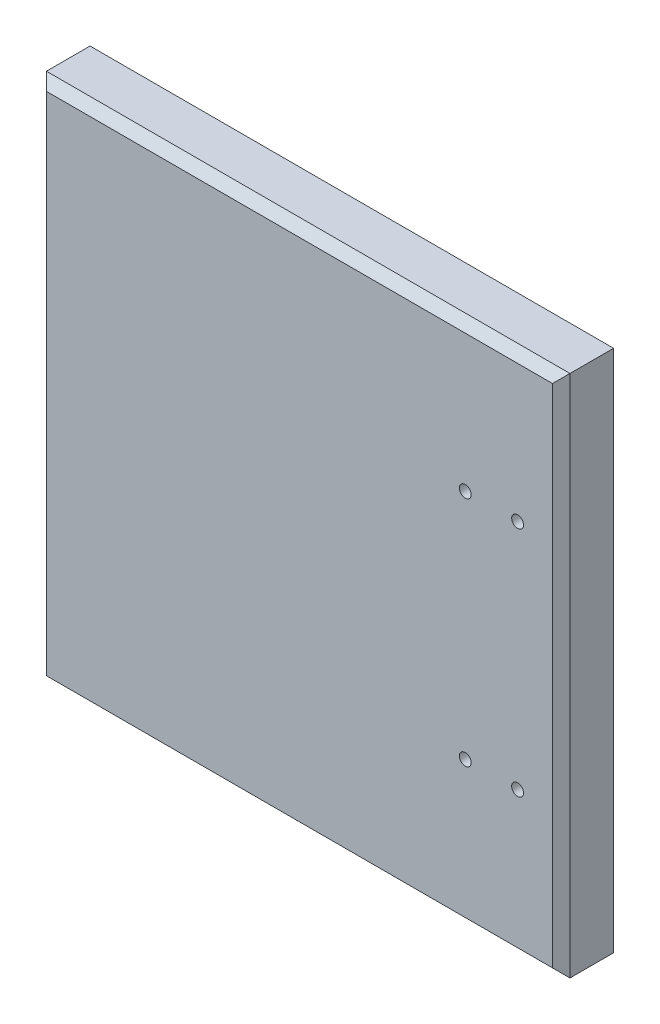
SolidWorks part; units mm, degrees
ref_plane "Face" through (0, 0, 0) normal (0, 0, 1) x (1, 0, 0)
ref_plane "Dessus" through (0, 0, 0) normal (0, 1, 0) x (1, 0, 0)
ref_plane "Droite" through (0, 0, 0) normal (1, 0, 0) x (0, 0, -1)
sketch "Esquisse1" plane through (0, 0, 0) normal (0, 0, 1) x (1, 0, 0)
  line L0 (-150, 150) -> (150, -150) construction
  line L1 (-150, 150) -> (150, 150)
  line L2 (-150, 150) -> (-150, -150)
  line L3 (-150, -150) -> (150, -150)
  line L4 (150, 150) -> (150, -150)
  dimension "D1" = 300
  dimension "D2" = 300
extrude "Extrusion1" add sketch "Esquisse1" along normal blind 30
chamfer "Chanfrein1" distance 5 angle 45 4 edges at (150, 0, 30) (0, 150, 30) (-150, 0, 30) (0, -150, 30)
hole_wizard "Trou taraudé M8x1.251" positions "Esquisse5" profile "Esquisse4" tap size "M8x1.25" standard "Ansi Métrique"
sketch "Esquisse5" plane through (0, 0, 30) normal (0, 0, 1) x (1, 0, 0)
  line L0 (150, 150) -> (150, -150) construction
  line L1 (95, 66.5) -> (125, 66.5) construction
  line L2 (95, 66.5) -> (95, -66.5) construction
  line L3 (95, -66.5) -> (125, -66.5) construction
  line L4 (125, 66.5) -> (125, -66.5) construction
  line L5 (-150, 150) -> (150, 150) construction
  point P0 (125, -66.5)
  point P1 (95, 66.5)
  point P2 (125, 66.5)
  point P3 (95, -66.5)
  dimension "D1" = 25
  dimension "D2" = 83.5
  dimension "D3" = 133
  dimension "D4" = 30
sketch "Esquisse4" plane through (125, -66.5, 30) normal (1, 0, 0) x (0, -1, 0)
  line L0 (0, 0) -> (0, 30)
  line L1 (0, 30) -> (3.4, 30)
  line L2 (3.4, 30) -> (3.4, 0)
  line L5 (3.4, 0) -> (0, 0)
  line L11 (0, -6.35) -> (0, 107.95) construction
  dimension "Diamètre du trou pour taraudage jusqu'au prochain" = 6.8
  dimension "Profondeur du trou pour taraudage jusqu'au prochain" = 30
